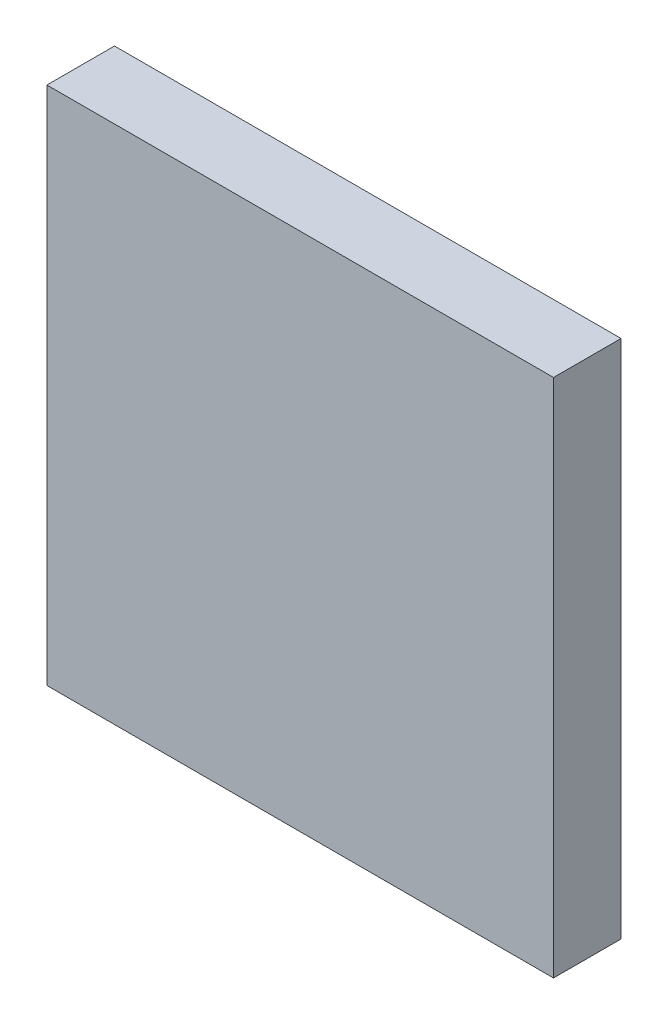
SolidWorks part; units mm, degrees
ref_plane "Plan de face" through (0, 0, 0) normal (0, 0, 1) x (1, 0, 0)
ref_plane "Plan de dessus" through (0, 0, 0) normal (0, 1, 0) x (1, 0, 0)
ref_plane "Plan de droite" through (0, 0, 0) normal (1, 0, 0) x (0, 0, -1)
sketch "Esquisse1" plane through (0, 0, 0) normal (0, 0, 1) x (1, 0, 0)
  line L1 (-102.7391, 61.6348) -> (47.2609, 61.6348)
  line L2 (-102.7391, 61.6348) -> (-102.7391, -92.3652)
  line L3 (-102.7391, -92.3652) -> (47.2609, -92.3652)
  line L4 (47.2609, 61.6348) -> (47.2609, -92.3652)
  dimension "D1" = 150
  dimension "D2" = 154
extrude "Boss.-Extru.1" add sketch "Esquisse1" along normal blind 20
